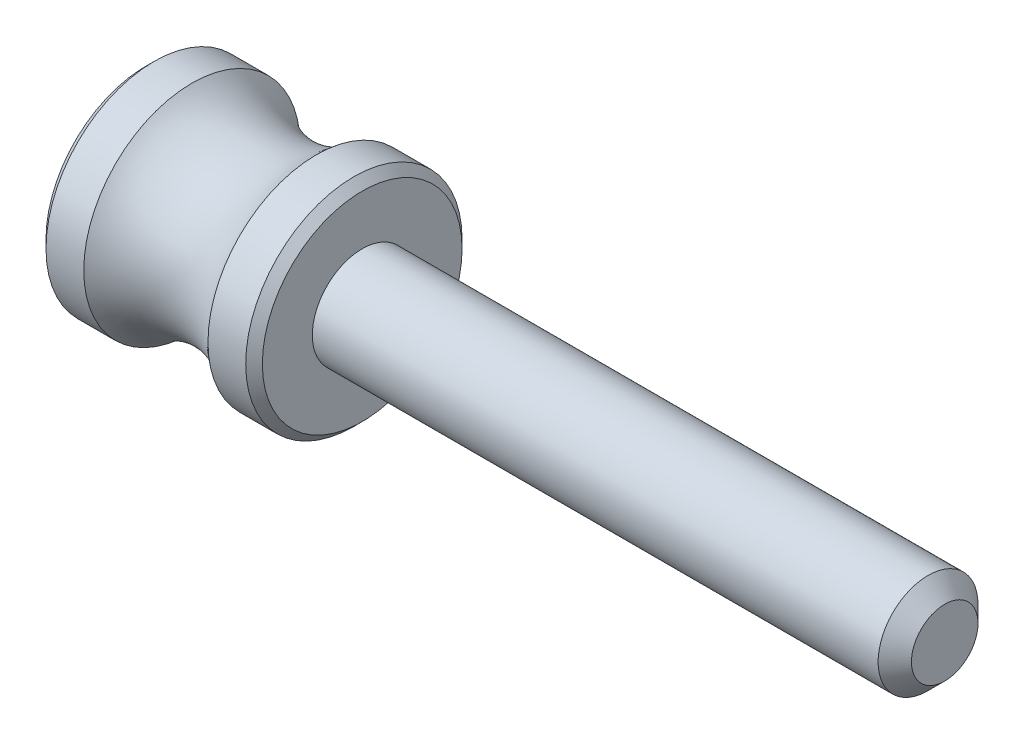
SolidWorks part; units mm, degrees
ref_plane "Front Plane" through (0, 0, 0) normal (0, 0, 1) x (1, 0, 0)
ref_plane "Top Plane" through (0, 0, 0) normal (0, 1, 0) x (1, 0, 0)
ref_plane "Right Plane" through (0, 0, 0) normal (1, 0, 0) x (0, 0, -1)
sketch "Sketch3" plane through (0, 0, 0) normal (1, 0, 0) x (0, 0, -1)
  circle A0 centre (0, 0) radius 6.5
  dimension "D1" = 13
extrude "Boss-Extrude1" add sketch "Sketch3" along normal blind 13
sketch "Sketch4" plane through (0, 0, 0) normal (0, 0, 1) x (1, 0, 0)
  line L0 (13, -6.5) -> (13, 6.5) construction
  line L1 (2.7679, 6.5) -> (10.2321, 6.5)
  line L3 (-1.6876, 0) -> (15.1024, 0)
  arc A0 (2.7679, 6.5) -> (10.2321, 6.5) centre (6.5, 10.5) ccw
  dimension "D1" = 10.5
  dimension "D2" = 6.5
revolve "Cut-Revolve1" cut sketch "Sketch4" angle 360 about L3
chamfer "Chamfer1" distance 0.5 angle 45 2 edges at (13, 0, -6.5) (0, 0, -6.5)
sketch "Sketch5" plane through (13, 0, 0) normal (1, 0, 0) x (0, 0, -1)
  circle A0 centre (0, 0) radius 3
  dimension "D1" = 6
extrude "Boss-Extrude2" add sketch "Sketch5" along normal blind 35
chamfer "Chamfer2" distance 1 angle 45 1 edges at (48, 0, -3)
